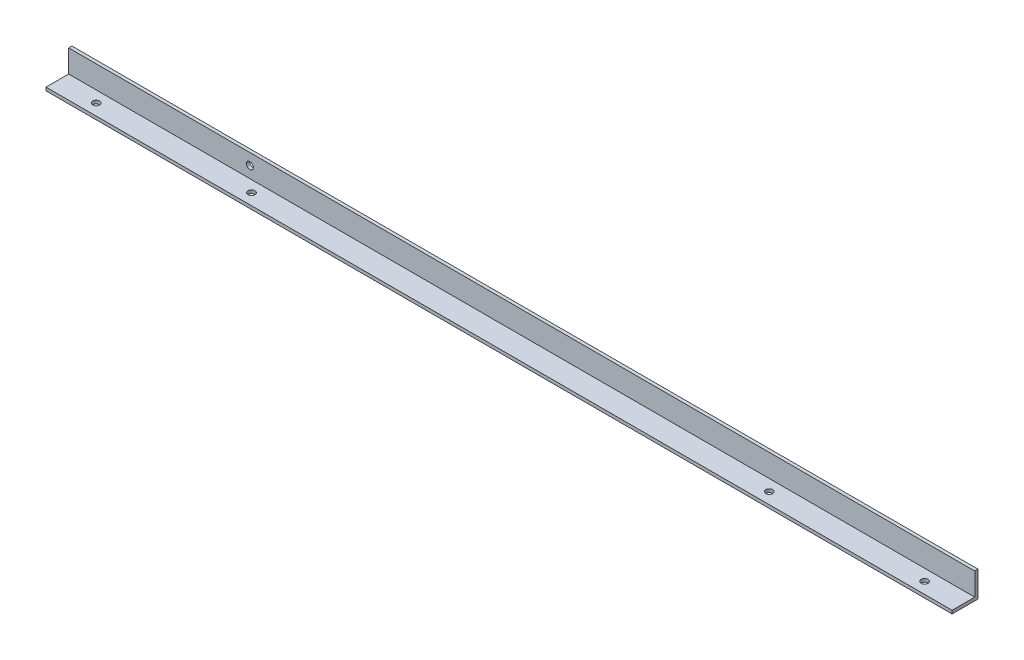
SolidWorks part; units mm, degrees
ref_plane "Front Plane" through (0, 0, 0) normal (0, 0, 1) x (1, 0, 0)
ref_plane "Top Plane" through (0, 0, 0) normal (0, 1, 0) x (1, 0, 0)
ref_plane "Right Plane" through (0, 0, 0) normal (1, 0, 0) x (0, 0, -1)
sketch "Sketch1" plane through (0, 0, 0) normal (0, 1, 0) x (1, 0, 0)
  line L1 (-444.5, 12.7) -> (444.5, 12.7)
  line L2 (-444.5, 12.7) -> (-444.5, -12.7)
  line L3 (-444.5, -12.7) -> (444.5, -12.7)
  line L4 (444.5, 12.7) -> (444.5, -12.7)
  line L5 (-444.5, 12.7) -> (444.5, -12.7) construction
  line L6 (-444.5, -12.7) -> (444.5, 12.7) construction
  point P0 (0, 0)
  dimension "D1" = 889
  dimension "D2" = 25.4
extrude "Boss-Extrude1" add sketch "Sketch1" along normal blind 3.175
sketch "Sketch2" plane through (0, 3.175, 0) normal (0, 1, 0) x (1, 0, 0)
  line L0 (-444.5, 12.7) -> (-444.5, 9.525)
  line L1 (-444.5, 12.7) -> (-444.5, -12.7) construction
  line L2 (-444.5, 9.525) -> (444.5, 9.525)
  line L3 (444.5, -12.7) -> (444.5, 12.7) construction
  line L4 (444.5, 9.525) -> (444.5, 12.7)
  line L5 (444.5, 12.7) -> (-444.5, 12.7)
  dimension "D1" = 3.175
extrude "Boss-Extrude2" add sketch "Sketch2" along normal blind 22.225
sketch "Sketch3" plane through (0, 3.175, 0) normal (0, 1, 0) x (1, 0, 0)
  line L0 (-444.5, -1.5875) -> (444.5, -1.5875) construction
  line L1 (-444.5, 9.525) -> (-444.5, -12.7) construction
  line L2 (444.5, -12.7) -> (444.5, 9.525) construction
  line L3 (-444.5, -12.7) -> (444.5, -12.7) construction
  circle A0 centre (-406.4, -1.5875) radius 3.3782
  circle A1 centre (-254, -1.5875) radius 3.3782
  circle A2 centre (406.4, -1.5875) radius 3.3782
  circle A3 centre (254, -1.5875) radius 3.3782
  dimension "D2" = 6.7564
  dimension "D3" = 6.7564
  dimension "D4" = 6.7564
  dimension "D5" = 6.7564
  dimension "D1" = 11.1125
  dimension "D6" = 38.1
  dimension "D7" = 152.4
  dimension "D8" = 38.1
  dimension "D9" = 152.4
extrude "Cut-Extrude1" cut sketch "Sketch3" against normal through all
sketch "Sketch4" plane through (0, 0, -9.525) normal (0, 0, 1) x (1, 0, 0)
  line L0 (-444.5, 14.2875) -> (444.5, 14.2875) construction
  line L1 (-444.5, 25.4) -> (-444.5, 3.175) construction
  line L2 (444.5, 25.4) -> (444.5, 3.175) construction
  line L3 (-444.5, 25.4) -> (444.5, 25.4) construction
  circle A0 centre (-266.7, 14.2875) radius 3.3782
  dimension "D2" = 6.7564
  dimension "D1" = 11.1125
  dimension "D3" = 177.8
extrude "Cut-Extrude2" cut sketch "Sketch4" against normal through all
